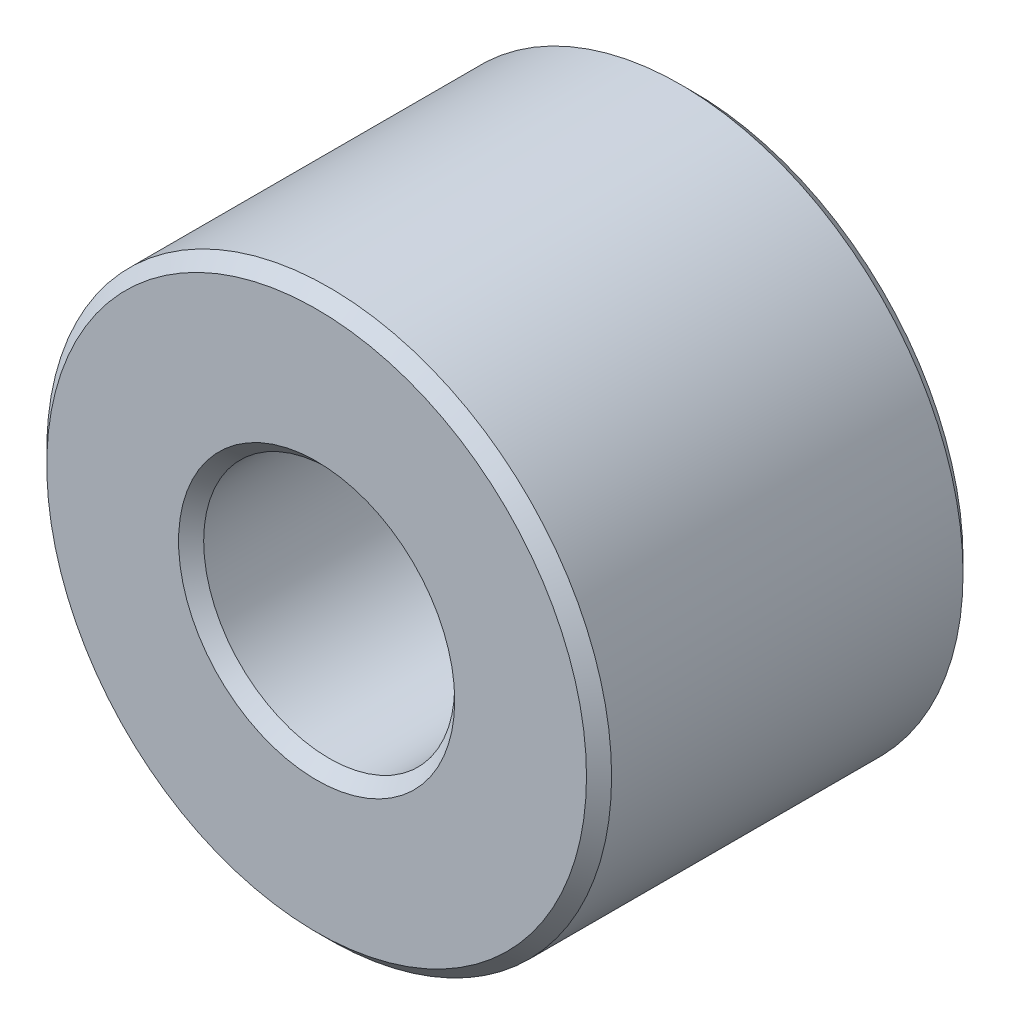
SolidWorks part; units mm, degrees
ref_plane "Front Plane" through (0, 0, 0) normal (0, 0, 1) x (1, 0, 0)
ref_plane "Top Plane" through (0, 0, 0) normal (0, 1, 0) x (1, 0, 0)
ref_plane "Right Plane" through (0, 0, 0) normal (1, 0, 0) x (0, 0, -1)
sketch "Sketch1" plane through (0, 0, 0) normal (0, 0, 1) x (1, 0, 0)
  circle A0 centre (0, 0) radius 10
  circle A1 centre (0, 0) radius 22.5
  dimension "D1" = 20
  dimension "D2" = 45
extrude "Boss-Extrude1" add sketch "Sketch1" along normal mid plane 30
chamfer "Chamfer1" distance 1 angle 45 4 edges at (10, 0, -15) (22.5, 0, -15) (10, 0, 15) (22.5, 0, 15)
